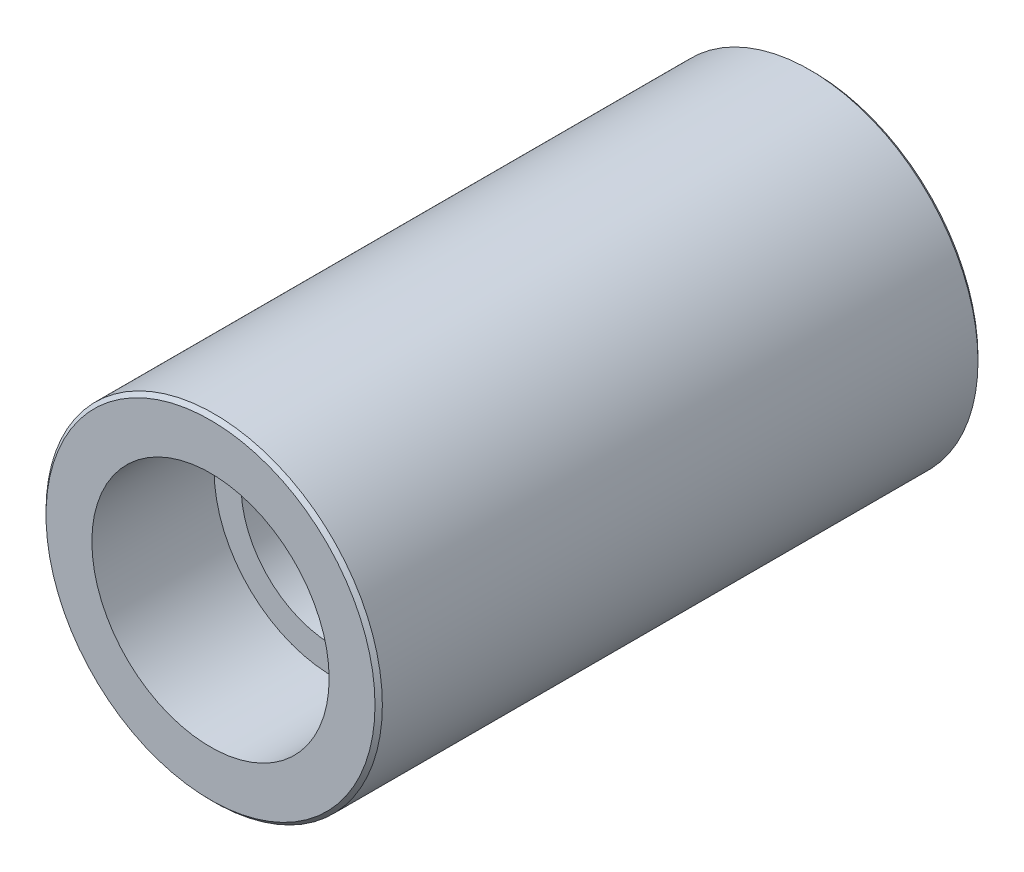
SolidWorks part; units mm, degrees
ref_plane "Front Plane" through (0, 0, 0) normal (0, 0, 1) x (1, 0, 0)
ref_plane "Top Plane" through (0, 0, 0) normal (0, 1, 0) x (1, 0, 0)
ref_plane "Right Plane" through (0, 0, 0) normal (1, 0, 0) x (0, 0, -1)
imported_body "Defeatured1"
sketch "Sketch1" plane through (0, 0, 7.2628) normal (0, 0, -1) x (-1, 0, 0)
  circle A0 centre (0, 0) radius 10.795
extrude "Cut-Extrude1" cut sketch "Sketch1" against normal up to surface (20.6772 mm away)
